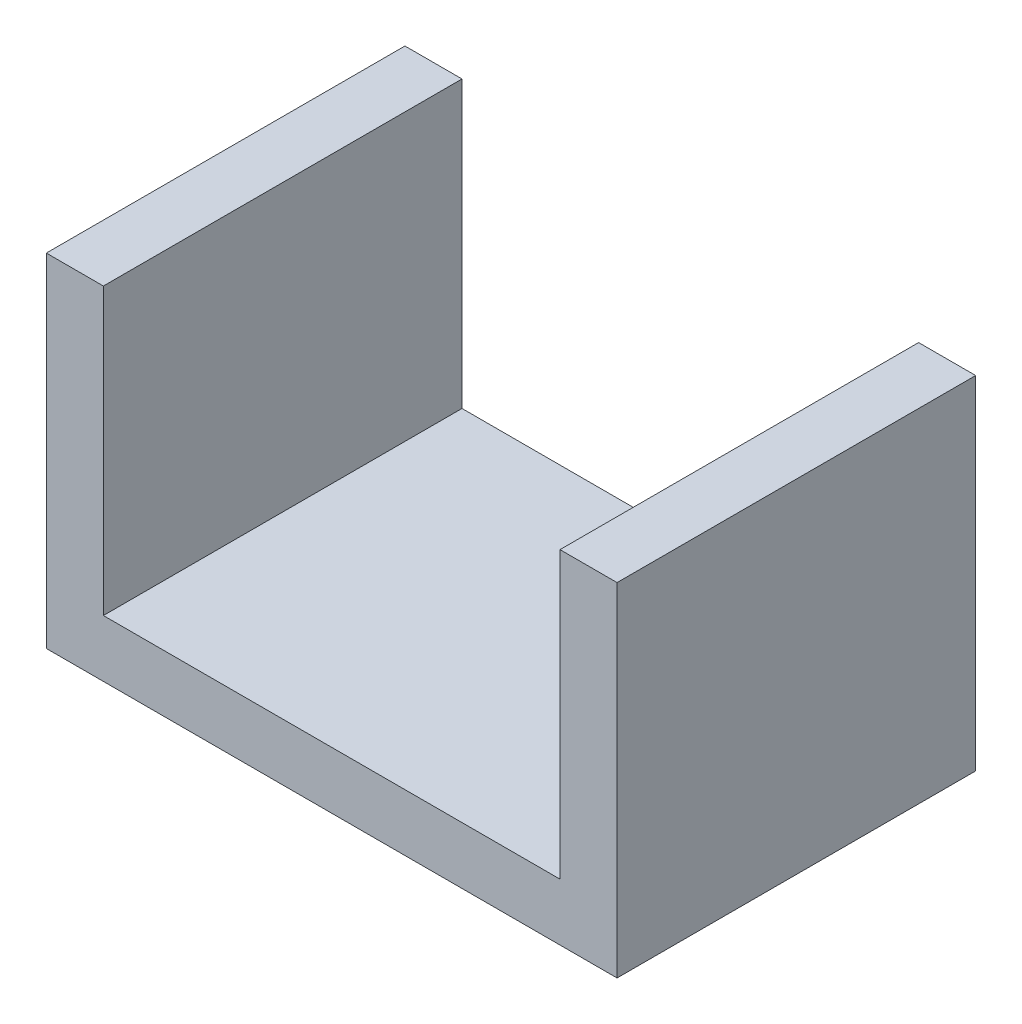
SolidWorks part; units mm, degrees
ref_plane "Front" through (0, 0, 0) normal (0, 0, 1) x (1, 0, 0)
ref_plane "Top" through (0, 0, 0) normal (0, 1, 0) x (1, 0, 0)
ref_plane "Right" through (0, 0, 0) normal (1, 0, 0) x (0, 0, -1)
sketch "Sketch3" plane through (0, 0, 0) normal (0, 0, 1) x (1, 0, 0)
  line L0 (-50, 60) -> (-50, 0)
  line L1 (-50, 0) -> (50, 0)
  line L2 (50, 0) -> (50, 60)
  line L3 (40, 10) -> (40, 60)
  line L4 (-40, 10) -> (40, 10)
  line L5 (-40, 60) -> (-40, 10)
  line L6 (40, 60) -> (50, 60)
  line L7 (-50, 60) -> (-40, 60)
  dimension "D2" = 60
  dimension "D3" = 100
  dimension "D1" = 10
extrude "Extrude1" add sketch "Sketch3" along normal mid plane 62.8345
ref_plane "Plane2" through (65, 0, 0) normal (1, 0, 0) x (0, 0, -1)
sketch "Sketch4" plane through (65, 0, 0) normal (1, 0, 0) x (0, 0, -1)
  circle A0 centre (2.78, 30.4041) radius 15.8523
